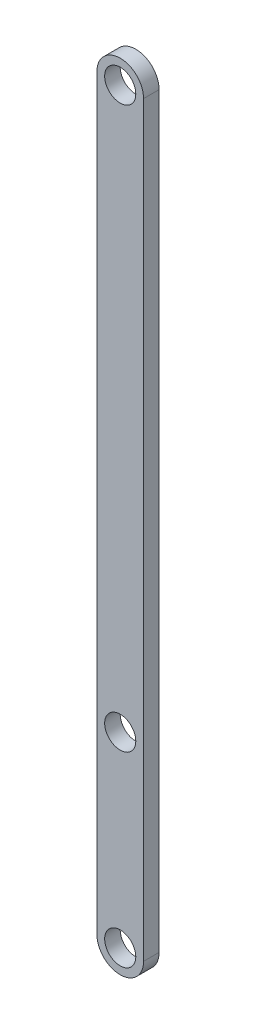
SolidWorks part; units mm, degrees
ref_plane "Face" through (0, 0, 0) normal (0, 0, 1) x (1, 0, 0)
ref_plane "Dessus" through (0, 0, 0) normal (0, 1, 0) x (1, 0, 0)
ref_plane "Droite" through (0, 0, 0) normal (1, 0, 0) x (0, 0, -1)
sketch "Esquisse1" plane through (0, 0, 0) normal (0, 0, 1) x (1, 0, 0)
  line L0 (-7.5, 240) -> (-7.5, 0)
  line L1 (7.5, 0) -> (7.5, 240)
  circle A0 centre (0, 0) radius 5
  circle A1 centre (0, 60) radius 5
  circle A2 centre (0, 240) radius 5
  arc A3 (7.5, 240) -> (-7.5, 240) centre (0, 240) ccw
  arc A4 (-7.5, 0) -> (7.5, 0) centre (0, 0) ccw
  dimension "D1" = 10
  dimension "D2" = 10
  dimension "D3" = 10
  dimension "D4" = 60
  dimension "D5" = 180
  dimension "D6" = 15
  dimension "D7" = 15
extrude "Extrusion1" add sketch "Esquisse1" along normal blind 5
